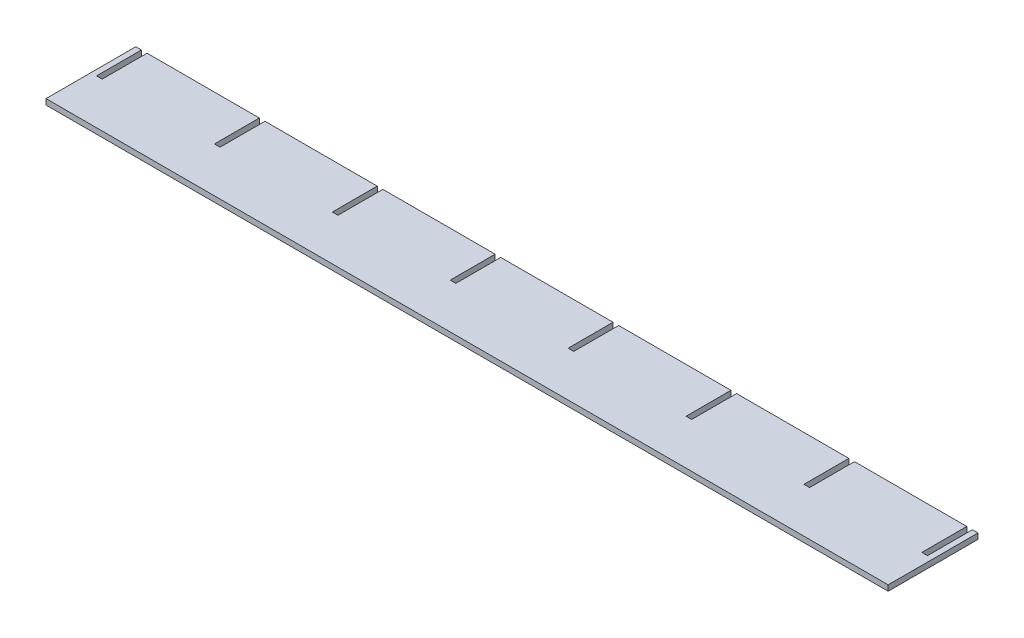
SolidWorks part; units mm, degrees
ref_plane "Front Plane" through (0, 0, 0) normal (0, 0, 1) x (1, 0, 0)
ref_plane "Top Plane" through (0, 0, 0) normal (0, 1, 0) x (1, 0, 0)
ref_plane "Right Plane" through (0, 0, 0) normal (1, 0, 0) x (0, 0, -1)
sketch "Sketch2" plane through (0, 0, 0) normal (0, 1, 0) x (1, 0, 0)
  line L0 (0, 0) -> (0, 101.6)
  line L1 (0, 101.6) -> (6.35, 101.6)
  line L2 (6.35, 101.6) -> (6.35, 50.8)
  line L3 (6.35, 50.8) -> (12.7, 50.8)
  line L4 (12.7, 50.8) -> (12.7, 101.6)
  line L5 (12.7, 101.6) -> (139.7, 101.6)
  line L6 (139.7, 101.6) -> (139.7, 50.8)
  line L7 (139.7, 50.8) -> (146.05, 50.8)
  line L8 (146.05, 50.8) -> (146.05, 101.6)
  line L9 (146.05, 101.6) -> (273.05, 101.6)
  line L10 (273.05, 101.6) -> (273.05, 50.8)
  line L11 (273.05, 50.8) -> (279.4, 50.8)
  line L12 (279.4, 50.8) -> (279.4, 101.6)
  line L13 (279.4, 101.6) -> (406.4, 101.6)
  line L14 (406.4, 50.8) -> (412.75, 50.8)
  line L15 (412.75, 50.8) -> (412.75, 101.6)
  line L16 (412.75, 101.6) -> (539.75, 101.6)
  line L17 (539.75, 101.6) -> (539.75, 50.8)
  line L18 (539.75, 50.8) -> (546.1, 50.8)
  line L19 (546.1, 50.8) -> (546.1, 101.6)
  line L20 (546.1, 101.6) -> (673.1, 101.6)
  line L21 (673.1, 101.6) -> (673.1, 50.8)
  line L22 (673.1, 50.8) -> (679.45, 50.8)
  line L23 (679.45, 50.8) -> (679.45, 101.6)
  line L24 (679.45, 101.6) -> (806.45, 101.6)
  line L25 (406.4, 101.6) -> (406.4, 50.8)
  line L26 (939.8, 101.6) -> (939.8, 50.8)
  line L27 (806.45, 101.6) -> (806.45, 50.8)
  line L28 (806.45, 50.8) -> (812.8, 50.8)
  line L29 (812.8, 50.8) -> (812.8, 101.6)
  line L30 (812.8, 101.6) -> (939.8, 101.6)
  line L31 (939.8, 50.8) -> (946.15, 50.8)
  line L32 (946.15, 50.8) -> (946.15, 101.6)
  line L33 (946.15, 101.6) -> (952.5, 101.6)
  line L34 (952.5, 101.6) -> (952.5, 0)
  line L35 (0, 0) -> (952.5, 0)
extrude "Boss-Extrude2" add sketch "Sketch2" along normal blind 6.35
